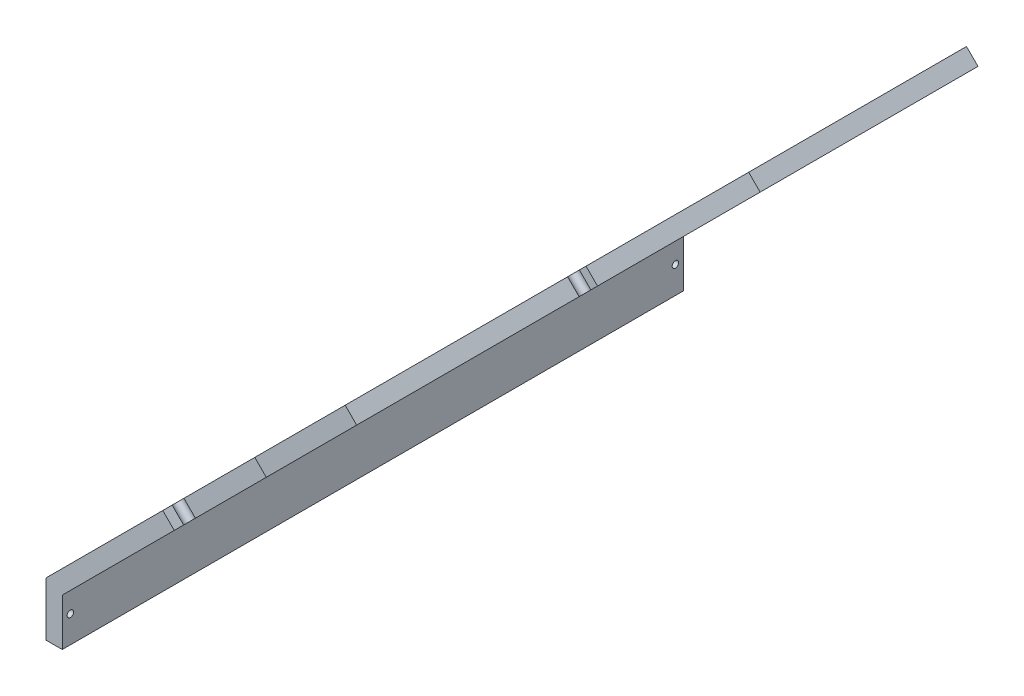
SolidWorks part; units mm, degrees
ref_plane "Plan de face" through (0, 0, 0) normal (0, 0, 1) x (1, 0, 0)
ref_plane "Plan de dessus" through (0, 0, 0) normal (0, 1, 0) x (1, 0, 0)
ref_plane "Plan de droite" through (0, 0, 0) normal (1, 0, 0) x (0, 0, -1)
sketch "Esquisse1" plane through (0, 0, 0) normal (0, 0, 1) x (1, 0, 0)
  line L0 (0, 0) -> (-5, 0)
  line L1 (-5, 0) -> (-5, 16.5711)
  line L2 (-5, 16.5711) -> (86.9671, 108.5381)
  line L3 (86.9671, 108.5381) -> (90.5026, 105.0026)
  line L4 (90.5026, 105.0026) -> (0, 14.5)
  line L5 (0, 14.5) -> (0, 0)
  dimension "D1" = 5
  dimension "D2" = 5
  dimension "D3" = 135
  dimension "D4" = 14.5
  dimension "D5" = 127.99
extrude "Boss.-Extru.1" add sketch "Esquisse1" along normal blind 191
sketch "Esquisse3" plane through (-10.7855, 10.7855, 0) normal (-0.7071, 0.7071, 0) x (0, 0, 1)
  line L0 (191, 138.243) -> (0, 138.243) construction
  line L1 (120.5, 138.243) -> (70.5, 138.243)
  line L2 (120.5, 138.243) -> (120.5, 143.243)
  line L3 (120.5, 143.243) -> (70.5, 143.243)
  line L4 (70.5, 138.243) -> (70.5, 143.243)
  point P6 (95.5, 138.243)
  dimension "D1" = 50
  dimension "D2" = 25
  dimension "D3" = 5
extrude "Boss.-Extru.2" add sketch "Esquisse3" against normal blind 5
sketch "Esquisse2" plane through (-10.7855, 10.7855, 0) normal (-0.7071, 0.7071, 0) x (0, 0, 1)
  line L0 (0, 138.243) -> (0, 8.182) construction
  line L1 (2.8787, 58.9465) -> (0, 58.9465)
  line L2 (5, 61.0678) -> (5, 96.8252)
  line L3 (2.8787, 98.9465) -> (0, 98.9465)
  line L4 (0, 58.9465) -> (0, 98.9465)
  line L5 (5, 98.9465) -> (0, 98.9465) construction
  line L6 (191, 138.243) -> (191, 8.182) construction
  line L7 (188.1213, 98.9465) -> (191, 98.9465)
  line L8 (186, 96.8252) -> (186, 61.0678)
  line L9 (188.1213, 58.9465) -> (191, 58.9465)
  line L10 (191, 98.9465) -> (191, 58.9465)
  line L11 (186, 98.9465) -> (194.881, 90.0655) construction
  line L12 (186, 58.9465) -> (198.6941, 71.6406) construction
  line L13 (5, 98.9465) -> (-18.5081, 75.4384) construction
  line L14 (5, 58.9465) -> (-14.8638, 78.8103) construction
  line L15 (70.5, 138.243) -> (58.4425, 150.3005) construction
  line L16 (120.5, 138.243) -> (134.4487, 152.1918) construction
  line L17 (70.5, 138.243) -> (0, 138.243) construction
  line L18 (191, 138.243) -> (120.5, 138.243) construction
  line L19 (5, 98.9465) -> (0, 138.243) construction
  line L20 (5, 58.9465) -> (0, 8.182) construction
  line L21 (70.5, 143.243) -> (120.5, 138.243) construction
  line L22 (191, 138.243) -> (186, 98.9465) construction
  line L23 (186, 58.9465) -> (191, 8.182) construction
  arc A0 (5, 96.8252) -> (2.8787, 98.9465) centre (3.9393, 97.8858) ccw
  arc A1 (2.8787, 58.9465) -> (5, 61.0678) centre (3.9393, 60.0071) ccw
  arc A2 (188.1213, 98.9465) -> (186, 96.8252) centre (187.0607, 97.8858) ccw
  arc A3 (186, 61.0678) -> (188.1213, 58.9465) centre (187.0607, 60.0071) ccw
  circle A4 centre (69.4393, 139.3037) radius 1.5
  circle A5 centre (121.5607, 139.3037) radius 1.5
  circle A6 centre (95.5, 140.743) radius 1
  circle A7 centre (188.5, 118.5948) radius 1
  circle A8 centre (188.5, 33.5642) radius 1
  circle A9 centre (2.5, 33.5642) radius 1
  circle A10 centre (2.5, 118.5948) radius 1
  dimension "D4" = 45
  dimension "D5" = 45
  dimension "D1" = 45
  dimension "D2" = 45
  dimension "D3" = 45
  dimension "D6" = 45
extrude "Enlèv. mat.-Extru.1" cut sketch "Esquisse2" against normal through all
sketch "Esquisse5" plane through (-5, 0, 0) normal (-1, 0, 0) x (0, 0, 1)
  line L0 (0, 16.5711) -> (5, 0) construction
  line L1 (191, 0) -> (0, 0) construction
  line L2 (191, 16.5711) -> (186, 0) construction
  circle A0 centre (2.5, 8.2855) radius 1
  circle A1 centre (188.5, 8.2855) radius 1
  dimension "D1" = 5
  dimension "D2" = 5
extrude "Enlèv. mat.-Extru.2" cut sketch "Esquisse5" against normal blind 5
